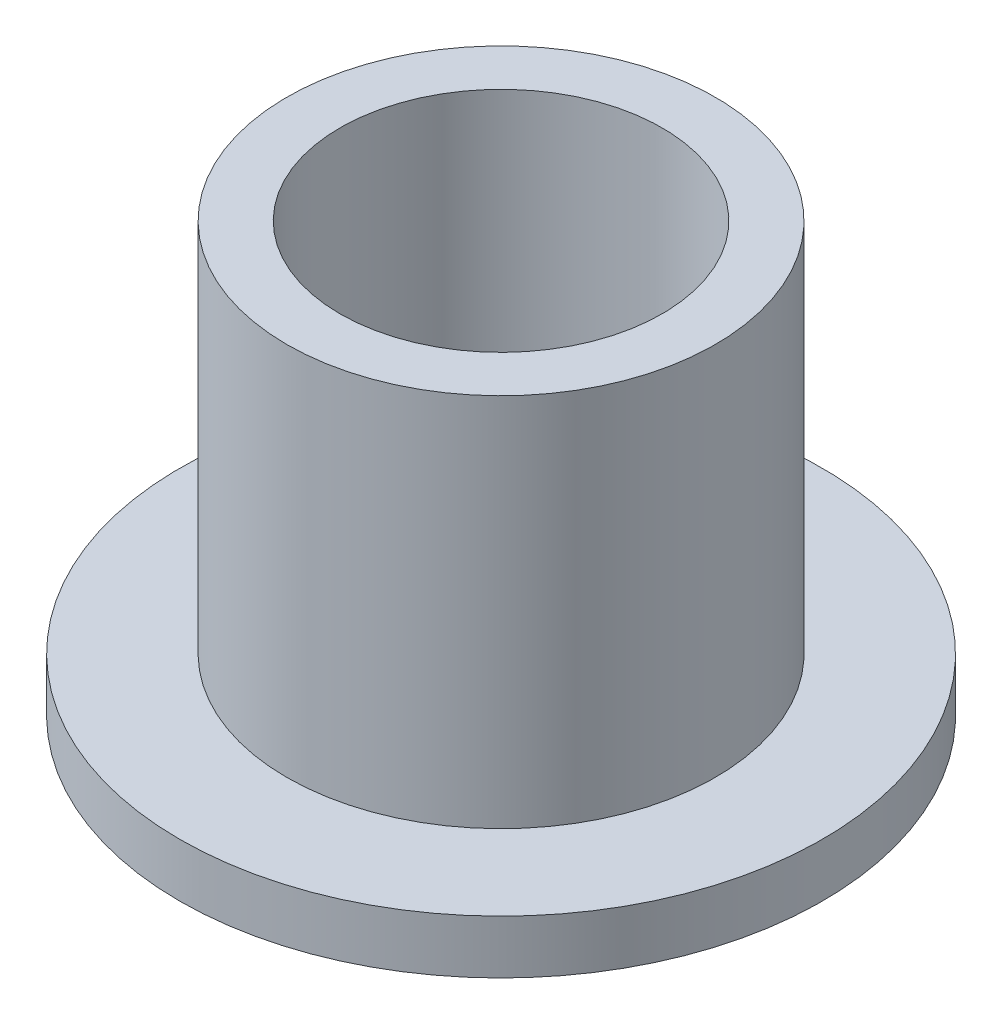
SolidWorks part; units mm, degrees
ref_plane "Front" through (0, 0, 0) normal (0, 0, 1) x (1, 0, 0)
ref_plane "Top" through (0, 0, 0) normal (0, 1, 0) x (1, 0, 0)
ref_plane "Right" through (0, 0, 0) normal (1, 0, 0) x (0, 0, -1)
sketch "Sketch1" plane through (0, 0, 0) normal (0, 1, 0) x (1, 0, 0)
  circle A0 centre (0, 0) radius 2.3876
  circle A1 centre (0, 0) radius 3.175
  circle A2 centre (0, 0) radius 4.7625
  dimension "ID" = 4.7752
  dimension "OD" = 6.35
  dimension "FlangeOD" = 9.525
sketch "Sketch2" plane through (0, 0, 0) normal (0, 1, 0) x (1, 0, 0)
  circle A0 centre (0, 0) radius 2.3876 construction
  circle A1 centre (0, 0) radius 3.175 construction
  circle A2 centre (0, 0) radius 2.3876
  circle A3 centre (0, 0) radius 3.175
extrude "Boss-Extrude1" add sketch "Sketch2" along normal blind 6.35
sketch "Sketch3" plane through (0, 0, 0) normal (0, 1, 0) x (1, 0, 0)
  circle A0 centre (0, 0) radius 4.7625 construction
  circle A1 centre (0, 0) radius 3.175 construction
  circle A2 centre (0, 0) radius 4.7625
  circle A3 centre (0, 0) radius 3.175
extrude "Boss-Extrude2" add sketch "Sketch3" along normal blind 0.7937
